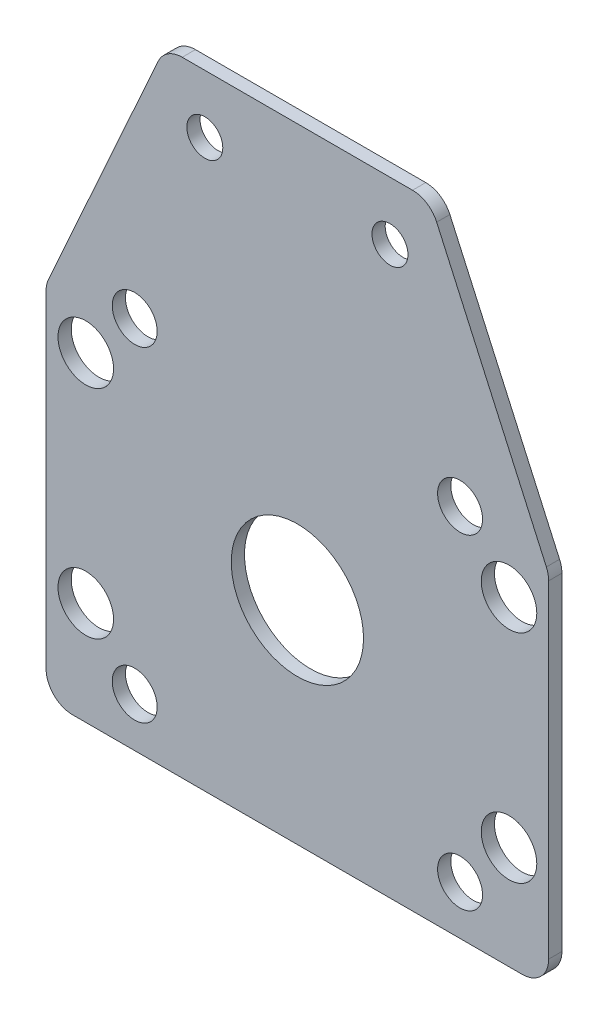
SolidWorks part; units mm, degrees
ref_plane "Plan de face" through (0, 0, 0) normal (0, 0, 1) x (1, 0, 0)
ref_plane "Plan de dessus" through (0, 0, 0) normal (0, 1, 0) x (1, 0, 0)
ref_plane "Plan de droite" through (0, 0, 0) normal (1, 0, 0) x (0, 0, -1)
sketch "Esquisse1" plane through (0, 0, 0) normal (0, 0, 1) x (1, 0, 0)
  line L0 (-42.5, 0) -> (42.5, 0)
  line L1 (47.5, 5) -> (47.5, 66.9268)
  line L2 (47.0596, 68.9786) -> (26.3267, 115.0518)
  line L3 (21.7671, 118) -> (-21.7671, 118)
  line L4 (-26.3267, 115.0518) -> (-47.0596, 68.9786)
  line L5 (-47.5, 66.9268) -> (-47.5, 5)
  arc A0 (-21.7671, 118) -> (-26.3267, 115.0518) centre (-21.7671, 113) ccw
  arc A1 (26.3267, 115.0518) -> (21.7671, 118) centre (21.7671, 113) ccw
  arc A2 (-47.0596, 68.9786) -> (-47.5, 66.9268) centre (-42.5, 66.9268) ccw
  arc A3 (47.5, 66.9268) -> (47.0596, 68.9786) centre (42.5, 66.9268) ccw
  arc A4 (42.5, 0) -> (47.5, 5) centre (42.5, 5) ccw
  arc A5 (-42.5, 0) -> (-47.5, 5) centre (-42.5, 5) cw
  point P7 (0, 118)
  point P10 (-25, 118)
  point P13 (25, 118)
  point P16 (-47.5, 68)
  point P21 (47.5, 0)
  point P24 (-47.5, 0)
  dimension "D5" = 5
  dimension "D1" = 50
  dimension "D2" = 95
  dimension "D3" = 118
  dimension "D4" = 68
sheet metal parameters "Tôlerie 1" thickness 2.5 parameters "D1"=2.5, "Epaisseur"=2.5
base flange "Tôle de base pliée1" sketch "Esquisse1" thickness 2.5 reverse thickness direction yes parameters "D1"=2.5
hole_wizard "Diamètre du perçage M25.0 (25.000000)1" positions "Esquisse4" profile "Esquisse3" hole size "M25.0" standard "ISO"
sketch "Esquisse4" plane through (0, 0, 2.5) normal (0, 0, 1) x (1, 0, 0)
  line L0 (-42.5, 0) -> (42.5, 0) construction
  line L1 (-47.5, 66.9268) -> (-47.5, 5) construction
  point P0 (0, 40)
  dimension "D1" = 40
  dimension "D2" = 47.5
sketch "Esquisse3" plane through (0, 40, 2.5) normal (1, 0, 0) x (0, -1, 0)
  line L0 (0, 0) -> (0, 2.5)
  line L1 (0, 2.5) -> (12.5, 2.5)
  line L2 (12.5, 2.5) -> (12.5, 0)
  line L5 (12.5, 0) -> (0, 0)
  line L11 (0, -6.35) -> (0, 107.95) construction
  dimension "Diamètre du perçage jusqu'au prochain" = 25
  dimension "Profondeur du perçage jusqu'au prochain" = 2.5
hole_wizard "Diamètre du perçage M10.5 (10.500000)1" positions "Esquisse6" profile "Esquisse5" hole size "M10.5" standard "ISO"
sketch "Esquisse6" plane through (0, 0, 2.5) normal (0, 0, 1) x (1, 0, 0)
  circle A0 centre (0, 40) radius 12.5 construction
  point P0 (-40, 19.5)
  point P1 (40, 19.5)
  point P2 (40, 60.5)
  point P3 (-40, 60.5)
  dimension "D1" = 80
  dimension "D2" = 41
  dimension "D3" = 40
  dimension "D4" = 20.5
sketch "Esquisse5" plane through (-40, 19.5, 2.5) normal (1, 0, 0) x (0, -1, 0)
  line L0 (0, 0) -> (0, 2.5)
  line L1 (0, 2.5) -> (5.25, 2.5)
  line L2 (5.25, 2.5) -> (5.25, 0)
  line L5 (5.25, 0) -> (0, 0)
  line L11 (0, -6.35) -> (0, 107.95) construction
  dimension "Diamètre du perçage jusqu'au prochain" = 10.5
  dimension "Profondeur du perçage jusqu'au prochain" = 2.5
hole_wizard "Diamètre du perçage M8.5 (8.500000)1" positions "Esquisse8" profile "Esquisse7" hole size "M8.5" standard "ISO"
sketch "Esquisse8" plane through (0, 0, 2.5) normal (0, 0, 1) x (1, 0, 0)
  circle A0 centre (0, 40) radius 12.5 construction
  point P0 (-30.75, 70.75)
  point P1 (30.75, 70.75)
  point P2 (30.75, 9.25)
  point P3 (-30.75, 9.25)
  dimension "D1" = 61.5
  dimension "D2" = 61.5
  dimension "D3" = 30.75
  dimension "D4" = 30.75
sketch "Esquisse7" plane through (-30.75, 70.75, 2.5) normal (1, 0, 0) x (0, -1, 0)
  line L0 (0, 0) -> (0, 2.5)
  line L1 (0, 2.5) -> (4.25, 2.5)
  line L2 (4.25, 2.5) -> (4.25, 0)
  line L5 (4.25, 0) -> (0, 0)
  line L11 (0, -6.35) -> (0, 107.95) construction
  dimension "Diamètre du perçage jusqu'au prochain" = 8.5
  dimension "Profondeur du perçage jusqu'au prochain" = 2.5
hole_wizard "Diamètre du perçage M6.8 (6.800000)1" positions "Esquisse10" profile "Esquisse9" hole size "M6.8" standard "ISO"
sketch "Esquisse10" plane through (0, 0, 2.5) normal (0, 0, 1) x (1, 0, 0)
  line L0 (-42.5, 0) -> (42.5, 0) construction
  point P0 (17.5, 107)
  point P1 (-17.5, 107)
  point P4 (0, 0)
  dimension "D1" = 35
  dimension "D2" = 107
  dimension "D3" = 17.5
sketch "Esquisse9" plane through (17.5, 107, 2.5) normal (1, 0, 0) x (0, -1, 0)
  line L0 (0, 0) -> (0, 2.5)
  line L1 (0, 2.5) -> (3.4, 2.5)
  line L2 (3.4, 2.5) -> (3.4, 0)
  line L5 (3.4, 0) -> (0, 0)
  line L11 (0, -6.35) -> (0, 107.95) construction
  dimension "Diamètre du perçage jusqu'au prochain" = 6.8
  dimension "Profondeur du perçage jusqu'au prochain" = 2.5
flat pattern "Etat déplié1"
sketch "Lignes de pliage1" plane through (0, 0, 0) normal (0, 1, 0) x (-1, 0, 0)
